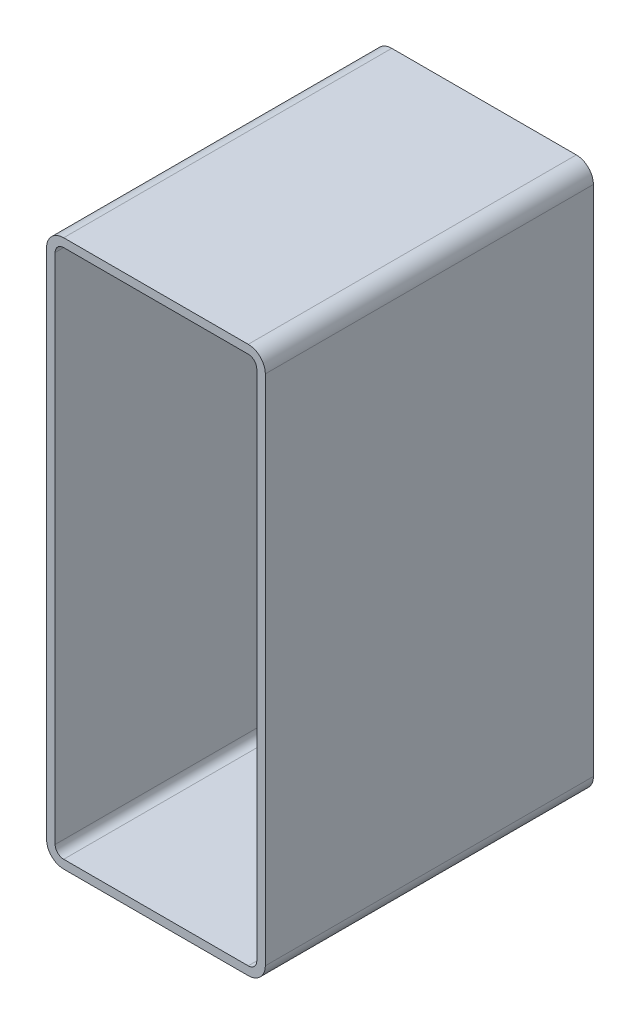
SolidWorks part; units mm, degrees
ref_plane "Front Plane" through (0, 0, 0) normal (0, 0, 1) x (1, 0, 0)
ref_plane "Top Plane" through (0, 0, 0) normal (0, 1, 0) x (1, 0, 0)
ref_plane "Right Plane" through (0, 0, 0) normal (1, 0, 0) x (0, 0, -1)
sketch "Sketch1" plane through (0, 0, 0) normal (0, 0, 1) x (1, 0, 0)
sketch_block_instance "HSS20x8x0.3125-1"
sketch_block "HSS20x8x0.3125"
extrude "Boss-Extrude1" add sketch "Sketch1" along normal blind 304.8
